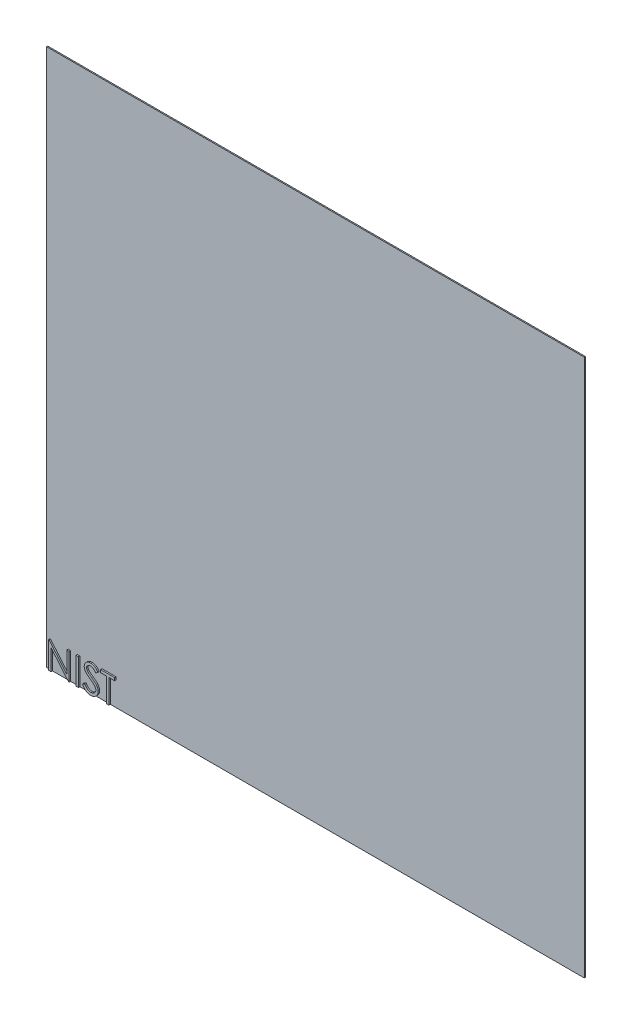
SolidWorks part; units mm, degrees
ref_plane "Front Plane" through (0, 0, 0) normal (0, 0, 1) x (1, 0, 0)
ref_plane "Top Plane" through (0, 0, 0) normal (0, 1, 0) x (1, 0, 0)
ref_plane "Right Plane" through (0, 0, 0) normal (1, 0, 0) x (0, 0, -1)
sketch "Sketch1" plane through (0, 0, 0) normal (0, 0, 1) x (1, 0, 0)
  line L1 (0, 0) -> (383.54, 0)
  line L2 (0, 0) -> (0, 383.54)
  line L3 (0, 383.54) -> (383.54, 383.54)
  line L4 (383.54, 0) -> (383.54, 383.54)
  dimension "D1" = 383.54
extrude "Boss-Extrude1" add sketch "Sketch1" along normal blind 0.7937
sketch "Sketch2" plane through (0, 0, 0.7937) normal (0, 0, 1) x (1, 0, 0)
  text T1 "NIST" font "Century Gothic" height in points 72
  point P0 (0, 0)
extrude "Boss-Extrude2" add sketch "Sketch2" along normal blind 1
